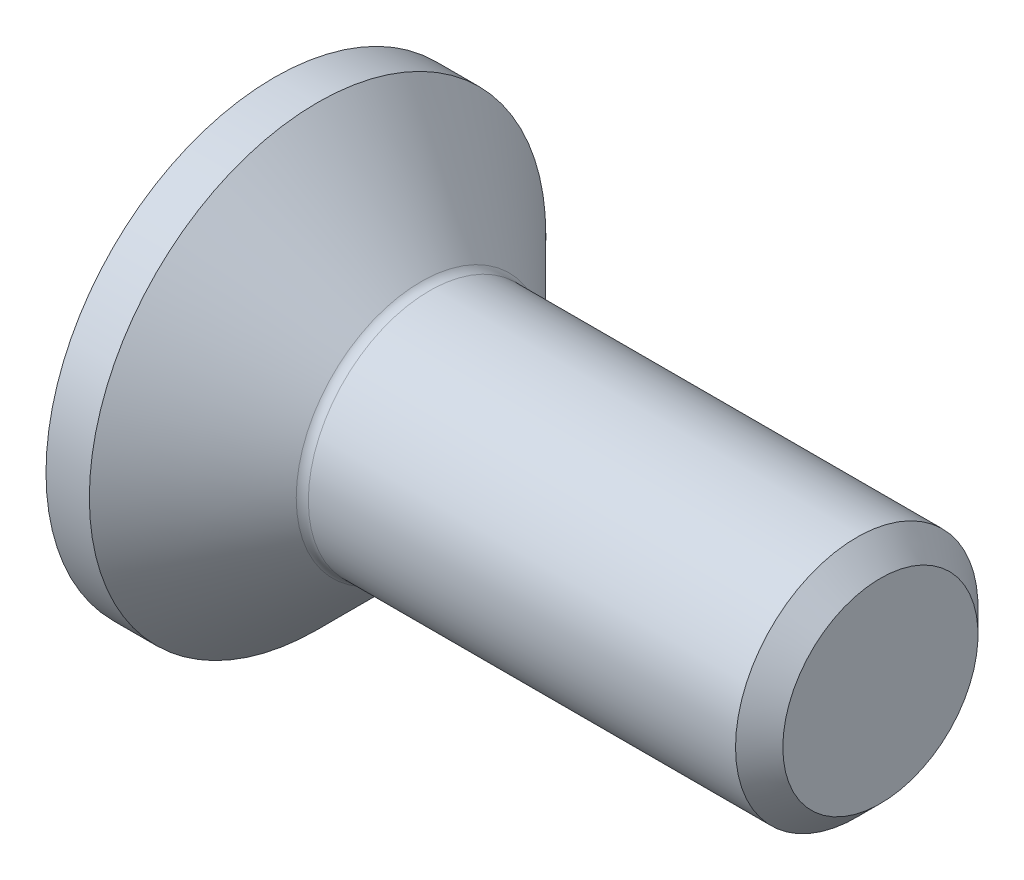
SolidWorks part; units mm, degrees
revolve "PreBroach" cut sketch "Sketch2"
sketch "Sketch2"
  line L0 (0, 1.25) -> (1.5, 1.25)
  line L1 (1.5, 1.25) -> (2.2217, 0)
  line L2 (0, 0) -> (127, 0) construction
  line L3 (2.2217, 0) -> (0, 0)
  line L4 (0, 0) -> (0, 1.25)
  line L5 (0, -1.25) -> (1.5, -1.25) construction
  line L6 (0, 0) -> (47.625, 0) construction
  line L8 (0, 3.765) -> (0, -3.765) construction
revolve "BaseBody" add sketch "BodySke"
sketch "BodySke" plane through (0, 0, 0) normal (0, 0, 1) x (1, 0, 0)
  line L0 (0, 0) -> (0, 3.765)
  line L1 (0.715, 3.765) -> (2.48, 2)
  line L2 (0, 3.765) -> (0.715, 3.765)
  line L3 (2.48, 2) -> (9.61, 2)
  line L4 (10, 1.61) -> (10, 0)
  line L5 (10, 0) -> (0, 0)
  line L6 (0, 0) -> (127, 0) construction
  line L7 (0.715, -3.765) -> (2.48, -2) construction
  line L8 (10, 1.61) -> (9.61, 2)
  line L9 (0, -3.765) -> (0.715, -3.765) construction
  line L10 (10, -1.61) -> (9.61, -2) construction
  line L11 (3.18, 8.35) -> (3.18, -13.875) construction
  line L12 (0, 19.05) -> (0, -3.175) construction
fillet "Fillet1" radius 0.2 1 edges at (2.48, 0, 2)
ref_plane "Plane1" through (0, 0, 0) normal (0, 0, 1) x (1, 0, 0)
ref_plane "Plane2" through (0, 0, 0) normal (0, 1, 0) x (1, 0, 0)
ref_plane "Plane3" through (0, 0, 0) normal (1, 0, 0) x (0, 0, -1)
sketch "Sketch3" plane through (0, 0, 0) normal (-1, 0, 0) x (0, 0, 1)
  line L0 (-1.25, -0.7217) -> (-1.25, 0.7217)
  line L1 (-1.25, 0.7217) -> (0, 1.4434)
  line L2 (0, 1.4434) -> (1.25, 0.7217)
  line L3 (1.25, 0.7217) -> (1.25, -0.7217)
  line L4 (1.25, -0.7217) -> (0, -1.4434)
  line L5 (0, -1.4434) -> (-1.25, -0.7217)
extrude "Hex" cut sketch "Sketch3" against normal blind 1.5
sketch "ThdSchSke" plane through (0, 0, 0) normal (0, 0, 1) x (1, 0, 0)
  line L0 (4.58, -1.61) -> (4.3069, -2)
  line L1 (4.58, -1.61) -> (4.8531, -2)
  line L2 (4.8531, -2) -> (4.8531, -2.5)
  line L3 (-3.175, 0) -> (5.1513, 0) construction
  line L4 (0, 3.765) -> (0, -3.765) construction
  line L5 (4.8531, -2.5) -> (4.3069, -2.5)
  line L6 (4.3069, -2.5) -> (4.3069, -2)
revolve "ThreadSchematic" [suppressed] cut sketch "ThdSchSke" angle 360 about L3
pattern_linear "ThdSchPat" [suppressed]
equation "\"Thread_minor@ThreadCosmetic\"  =  \"Minor_dia@BodySke\""
equation "\"D1@Sketch3\" = \"Hex_size@Sketch3\" / 2"
equation "\"D2@Sketch3\" = \"D1@Sketch3\""
equation "\"D3@Sketch3\" = \"Hex_size@Sketch3\""
equation "\"Thread_length@ThreadCosmetic\" = ((sgn( (\"Length@BodySke\" - \"Advance@BodySke\" * 3.0 - \"Head_ht@BodySke\" ) - \"Thread_nom@BodySke\" )-1)*( (\"Length@BodySke\" - \"Advance@BodySke\" * 3.0 - \"Head_ht@BodySke\" "
equation "\"Thread_minor@ThdSchSke\" = \"Minor_dia@BodySke\""
equation "\"Diameter@ThdSchSke\" = \"Diameter@BodySke\""
equation "\"Overcut@ThdSchSke\" = \"Diameter@BodySke\" * 1.25"
equation "\"Start@ThdSchSke\" = 0.000001 + \"Length@BodySke\" - \"Thread_length@ThreadCosmetic\"  '---Countersunk---"
equation "\"Num_threads@ThdSchPat\" = int( \"Thread_length@ThreadCosmetic\" / \"Advance@BodySke\" + 0.999 )  + 1"
equation "\"Advance@ThdSchPat\" = \"Thread_length@ThreadCosmetic\" /  (\"Num_threads@ThdSchPat\" - 1) 'relax it"
equation "\"Num_threads@ThdSchPat\" = \"Num_threads@ThdSchPat\" - sgn( \"Num_threads@ThdSchPat\" - 1) '---chamfered tips only---"
